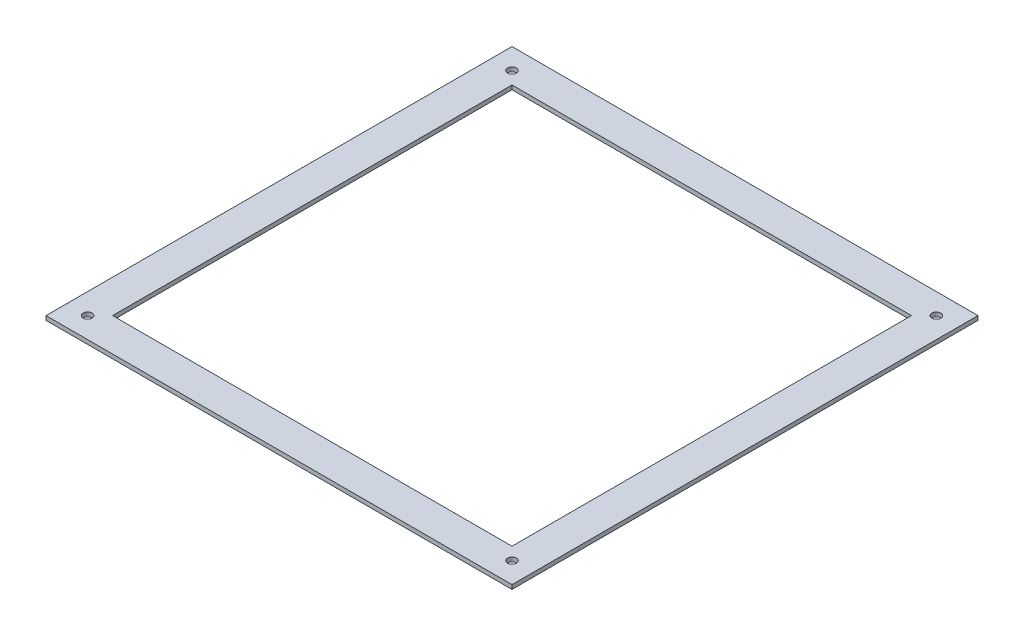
SolidWorks part; units mm, degrees
ref_plane "Front" through (0, 0, 0) normal (0, 0, 1) x (1, 0, 0)
ref_plane "Top" through (0, 0, 0) normal (0, 1, 0) x (1, 0, 0)
ref_plane "Right" through (0, 0, 0) normal (1, 0, 0) x (0, 0, -1)
sketch "Sketch1" plane through (0, 0, 0) normal (0, 1, 0) x (1, 0, 0)
  line L1 (-177.8, -177.8) -> (177.8, -177.8)
  line L2 (-177.8, -177.8) -> (-177.8, 177.8)
  line L3 (-177.8, 177.8) -> (177.8, 177.8)
  line L4 (177.8, -177.8) -> (177.8, 177.8)
  line L5 (-177.8, -177.8) -> (177.8, 177.8) construction
  line L6 (-177.8, 177.8) -> (177.8, -177.8) construction
  line L7 (-152.4, -152.4) -> (152.4, -152.4)
  line L8 (-152.4, -152.4) -> (-152.4, 152.4)
  line L9 (-152.4, 152.4) -> (152.4, 152.4)
  line L10 (152.4, -152.4) -> (152.4, 152.4)
  line L11 (-152.4, -152.4) -> (152.4, 152.4) construction
  line L12 (-152.4, 152.4) -> (152.4, -152.4) construction
  point P0 (0, 0)
  point P6 (0, 0)
  dimension "D1" = 355.6
  dimension "D2" = 25.4
extrude "Boss-Extrude1" add sketch "Sketch1" along normal blind 3.175
hole_wizard "1/4 Clearance Hole2" positions "Sketch5" profile "Sketch4" hole size "1/4" standard "Ansi Inch"
sketch "Sketch5" plane through (0, 3.175, 0) normal (0, 1, 0) x (-1, 0, 0)
  circle A0 centre (161.925, -161.925) radius 3.3782 construction
  circle A1 centre (-161.925, -161.925) radius 3.3782 construction
  circle A2 centre (-161.925, 161.925) radius 3.3782 construction
  circle A3 centre (161.925, 161.925) radius 3.3782 construction
  circle A4 centre (161.925, -161.925) radius 3.3782
  circle A5 centre (-161.925, -161.925) radius 3.3782
  circle A6 centre (-161.925, 161.925) radius 3.3782
  circle A7 centre (161.925, 161.925) radius 3.3782
  point P0 (161.925, 161.925)
  point P1 (-161.925, 161.925)
  point P3 (-161.925, -161.925)
  point P5 (161.925, -161.925)
sketch "Sketch4" plane through (-161.925, 3.175, 161.925) normal (1, 0, 0) x (0, 0, 1)
  line L0 (0, 0) -> (0, 8.3798)
  line L1 (0, 8.3798) -> (3.3782, 6.35)
  line L2 (3.3782, 6.35) -> (3.3782, 0)
  line L5 (3.3782, 0) -> (0, 0)
  line L10 (0, 8.3798) -> (-3.3782, 6.35) construction
  line L11 (0, -6.35) -> (0, 107.95) construction
  dimension "Hole Dia." = 6.7564
  dimension "Hole Depth" = 6.35
  dimension "Drill Angle" = 118
